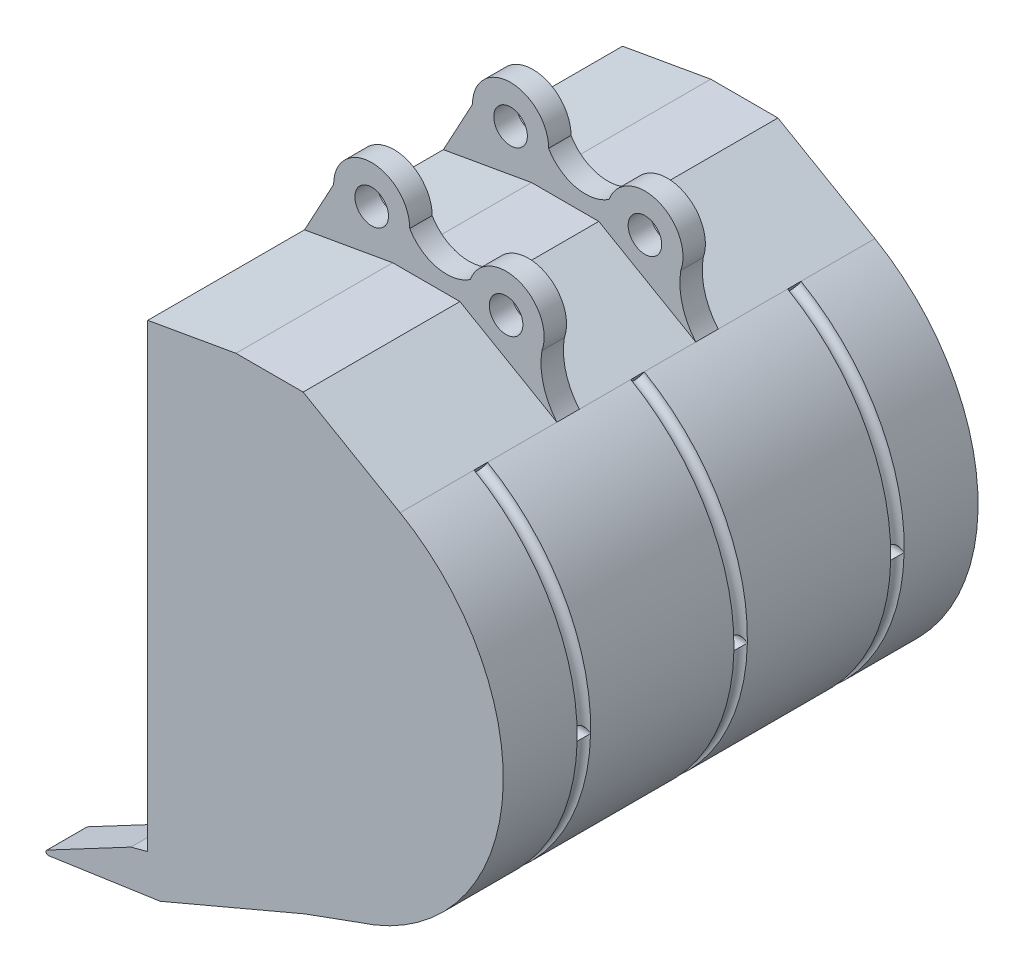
SolidWorks part; units mm, degrees
ref_plane "Front" through (0, 0, 0) normal (0, 0, 1) x (1, 0, 0)
ref_plane "Top" through (0, 0, 0) normal (0, 1, 0) x (1, 0, 0)
ref_plane "Right" through (0, 0, 0) normal (1, 0, 0) x (0, 0, -1)
sketch "Sketch1" plane through (0, 0, 0) normal (0, 0, 1) x (1, 0, 0)
  line L0 (0, 0) -> (0, -1100)
  line L1 (0, -1100) -> (469.8463, -928.9899)
  line L2 (0, 0) -> (196.9616, 34.7296)
  line L3 (196.9616, 34.7296) -> (346.9616, 34.7296)
  line L4 (346.9616, 34.7296) -> (563.4679, -90.2704)
  arc A0 (563.4679, -90.2704) -> (469.8463, -928.9899) centre (333.1752, -489.1491) cw
  dimension "D1" = 1100
  dimension "D2" = 500
  dimension "D3" = 70
  dimension "D4" = 200
  dimension "D5" = 100
  dimension "D6" = 150
  dimension "D7" = 250
  dimension "D8" = 150
extrude "Extrude1" add sketch "Sketch1" along normal mid plane 1060
sketch "Sketch2" plane through (0, 0, 0) normal (0, 0, 1) x (1, 0, 0)
  line L0 (0, 0) -> (0, -1100) construction
  line L1 (0, -40.6171) -> (0, -1057.4329)
  line L3 (203.9075, -4.6627) -> (203.9075, -983.2166)
  line L6 (40, -1042.8741) -> (456.1655, -891.4022)
  line L7 (40, -33.564) -> (40, -1042.8741)
  line L8 (203.9075, -4.6627) -> (40, -33.564)
  line L9 (0, -1057.4329) -> (203.9075, -983.2166)
  line L11 (203.9075, -4.6627) -> (0, -40.6171)
  dimension "D1" = 40
extrude "Cut-Extrude1" cut sketch "Sketch2" against normal mid plane 1000
shell "Shell1" thickness 50
ref_plane "Plane1" through (0, 0, 130) normal (0, 0, 1) x (1, 0, 0)
sketch "Sketch3" plane through (0, 0, 130) normal (0, 0, 1) x (1, 0, 0)
  line L0 (0, 0) -> (450, 0) construction
  line L1 (150, 0) -> (150, 120) construction
  line L2 (450, 0) -> (450, 60) construction
  line L3 (0, 0) -> (65, 120)
  line L7 (563.4679, -90.2704) -> (346.9616, 34.7296)
  line L8 (346.9616, 34.7296) -> (196.9616, 34.7296)
  line L9 (196.9616, 34.7296) -> (0, 0)
  arc A0 (65, 120) -> (235, 120) centre (150, 120) cw
  arc A1 (370, 88.7228) -> (530, 31.2772) centre (450, 60) cw
  arc A2 (235, 120) -> (370, 88.7228) centre (317.1694, 167.678) ccw
  arc A3 (530, 31.2772) -> (563.4679, -90.2704) centre (677.9624, 6.6369) ccw
  circle A4 centre (450, 60) radius 37.5
  circle A5 centre (150, 120) radius 37.5
  dimension "D5" = 85
  dimension "D6" = 85
  dimension "D7" = 95
  dimension "D8" = 150
  dimension "D9" = 75
  dimension "D10" = 75
  dimension "D1" = 450
  dimension "D2" = 120
  dimension "D3" = 60
  dimension "D4" = 150
  dimension "D11" = 530
  dimension "D12" = 120
  dimension "D13" = 235
  dimension "D14" = 370
extrude "Extrude2" add sketch "Sketch3" along normal blind 50
mirror "Mirror1" about plane through (0, 0, 0) normal (0, 0, 1)
sketch "Sketch4" plane through (0, 0, 530) normal (0, 0, 1) x (1, 0, 0)
  line L0 (203.9075, -972.5749) -> (-37.574, -1037.2796)
  line L1 (203.9075, -972.5749) -> (350.0977, -972.5749)
  line L3 (0, 0) -> (0, -1100) construction
  line L4 (0, -1100) -> (469.8463, -928.9899) construction
  line L5 (350.0977, -972.5749) -> (27.921, -1109.3308)
  line L7 (-37.574, -1037.2796) -> (-224.4655, -1136.4505)
  line L8 (-221.3979, -1145.8145) -> (27.921, -1109.3308)
  arc A0 (-221.3979, -1145.8145) -> (-224.4655, -1136.4505) centre (-222.1218, -1140.8672) cw
  point P8 (-250, -1150)
  point P12 (-250, -1150)
  dimension "D7" = 5
  dimension "D1" = 250
  dimension "D2" = 75
  dimension "D3" = 350
  dimension "D4" = 67
  dimension "D5" = 1150
  dimension "D6" = 250
extrude "Extrude3" add sketch "Sketch4" against normal blind 90
pattern_linear "LPattern1" count 5 spacing 242.5
sketch "Sketch5" plane through (0, 0, 0) normal (0, 0, 1) x (1, 0, 0)
  arc A0 (469.8463, -928.9899) -> (563.4679, -90.2704) centre (333.1752, -489.1491) ccw construction
  arc A1 (469.8463, -928.9899) -> (563.4679, -90.2704) centre (333.1752, -489.1491) ccw
ref_plane "Plane2" through (563.4679, -90.2704, 0) normal (-0.866, 0.5, 0) x (0, 0, 1)
sketch "Sketch6" plane through (563.4679, -90.2704, 0) normal (-0.866, 0.5, 0) x (0, 0, 1)
  circle A0 centre (0, 0) radius 15
  dimension "D1" = 30
sweep "Cut-Sweep1" cut profiles "Sketch6" path "Sketch5"
pattern_linear "LPattern2" count 2 spacing 350 count 2 spacing 350
sketch "Sketch7" plane through (0, 0, 0) normal (1, 0, 0) x (0, 0, -1)
  line L0 (350, 0) -> (350, -500) construction
  line L1 (-350, 0) -> (-350, -500) construction
  line L4 (0, 0) -> (0, -500) construction
  circle A0 centre (350, -500) radius 15
  circle A1 centre (0, -500) radius 15
  circle A2 centre (-350, -500) radius 15
  dimension "D2" = 350
  dimension "D4" = 30
  dimension "D5" = 30
  dimension "D6" = 30
  dimension "D3" = 350
  dimension "D1" = 500
extrude "Cut-Extrude3" cut sketch "Sketch7" along normal through all
